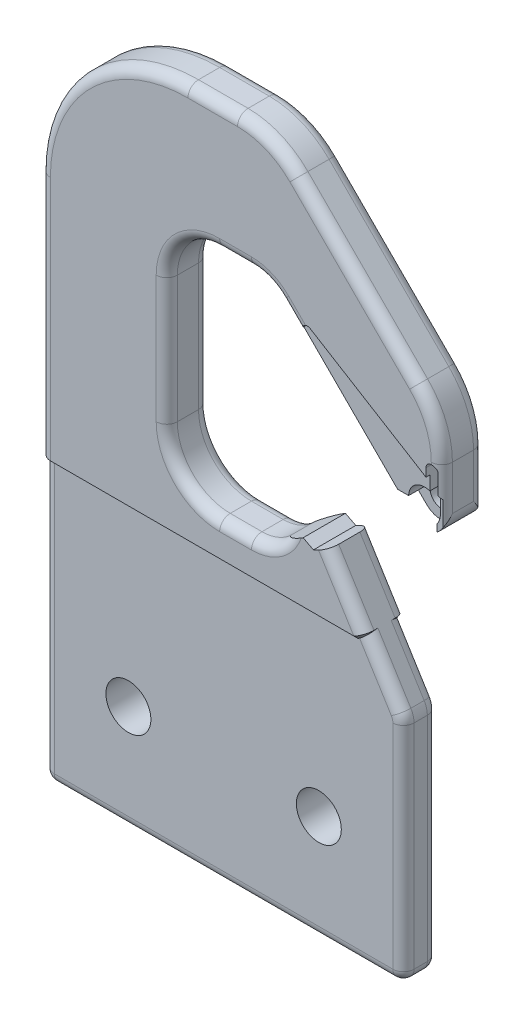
SolidWorks part; units mm, degrees
ref_plane "Front Plane" through (0, 0, 0) normal (0, 0, 1) x (1, 0, 0)
ref_plane "Top Plane" through (0, 0, 0) normal (0, 1, 0) x (1, 0, 0)
ref_plane "Right Plane" through (0, 0, 0) normal (1, 0, 0) x (0, 0, -1)
sketch "Sketch1" plane through (0, 0, 0) normal (0, 0, 1) x (1, 0, 0)
  line L1 (0, 0) -> (120.65, 0)
  line L2 (0, 0) -> (0, 177.8)
  line L3 (0, 177.8) -> (120.65, 177.8)
  line L4 (120.65, 0) -> (120.65, 177.8)
extrude "Extrude1" add sketch "Sketch1" along normal blind 12.7
fillet "Fillet1" radius 44.45 1 edges at (0, 177.8, 6.35)
sketch "Sketch3" plane through (0, 0, 12.7) normal (0, 0, 1) x (1, 0, 0)
  line L0 (0, 133.35) -> (0, 0) construction
  line L1 (38.1, 139.7) -> (76.2, 139.7)
  line L2 (38.1, 139.7) -> (38.1, 69.85)
  line L3 (38.1, 69.85) -> (76.2, 69.85)
  line L4 (76.2, 139.7) -> (76.2, 69.85)
  line L5 (0, 0) -> (120.65, 0) construction
  dimension "D1" = 38.1
  dimension "D2" = 69.85
  dimension "D3" = 38.1
  dimension "D4" = 69.85
extrude "Cut-Extrude1" cut sketch "Sketch3" against normal through all
fillet "Fillet2" radius 12.7 2 edges at (76.2, 69.85, 6.35) (76.2, 139.7, 6.35)
fillet "Fillet12" radius 15.875 2 edges at (38.1, 69.85, 6.35) (38.1, 139.7, 6.35)
sketch "Sketch5" plane through (0, 0, 12.7) normal (0, 0, 1) x (1, 0, 0)
  line L0 (72.4803, 135.9803) -> (120.65, 87.8105)
  line L1 (120.65, 0) -> (120.65, 177.8) construction
  line L2 (72.4803, 73.5697) -> (84.6446, 81.1219)
  line L3 (84.6446, 81.1219) -> (120.65, 23.1274)
  line L4 (120.65, 23.1274) -> (120.65, 87.8105)
  line L5 (72.4803, 135.9803) -> (72.4803, 73.5697)
  arc A0 (76.2, 127) -> (63.5, 139.7) centre (63.5, 127) ccw construction
  arc A1 (63.5, 69.85) -> (76.2, 82.55) centre (63.5, 82.55) ccw construction
extrude "Cut-Extrude2" cut sketch "Sketch5" against normal through all
fillet "Fillet3" radius 50.8 1 edges at (120.65, 177.8, 6.35)
sketch "Sketch18" plane through (0, 0, 12.7) normal (0, 0, 1) x (1, 0, 0)
  line L1 (0, 0) -> (120.4195, 0)
  line L2 (0, 0) -> (0, -25.4)
  line L3 (0, -25.4) -> (120.4195, -25.4)
  line L4 (120.4195, 0) -> (120.4195, -25.4)
extrude "Extrude2" add sketch "Sketch18" against normal blind 12.7
hole_wizard "1/2 Clearance Hole1" positions "3DSketch1" profile "Sketch9" hole size "1/2" standard "Ansi Inch"
sketch3d "3DSketch1"
  line L0 (120.4195, 0, 12.7) -> (120.65, 0, 12.7) construction
  line L1 (0, 133.35, 12.7) -> (0, -25.4, 12.7) construction
  point P0 (25.4, 6.35, 12.7)
  point P2 (82.55, 6.35, 12.7)
  dimension "D1" = 6.35
  dimension "D2" = 6.35
  dimension "D3" = 57.15
  dimension "D4" = 25.4
sketch "Sketch9" plane through (25.4, 6.35, 12.7) normal (1, 0, 0) x (0, -1, 0)
  line L0 (0, 0) -> (0, 29.4535)
  line L1 (0, 29.4535) -> (6.7462, 25.4)
  line L2 (6.7462, 25.4) -> (6.7462, 0)
  line L5 (6.7462, 0) -> (0, 0)
  line L10 (0, 29.4535) -> (-6.7462, 25.4) construction
  line L11 (0, -6.35) -> (0, 107.95) construction
  dimension "Hole Dia." = 13.4925
  dimension "Hole Depth" = 25.4
  dimension "Drill Angle" = 118
sketch "Sketch11" plane through (0, 0, 12.7) normal (0, 0, 1) x (1, 0, 0)
  line L1 (0, 133.35) -> (0, -25.4) construction
  line L2 (107.95, 63.3788) -> (129.5271, 63.3788)
  line L3 (107.95, 63.3788) -> (107.95, -27.3076)
  line L4 (107.95, -27.3076) -> (129.5271, -27.3076)
  line L9 (129.5271, 63.3788) -> (129.5271, -27.3076)
  dimension "D1" = 107.95
extrude "Cut-Extrude4" cut sketch "Sketch11" against normal through all
sketch "Sketch12" plane through (0, 0, 12.7) normal (0, 0, 1) x (1, 0, 0)
  line L0 (86.5199, 78.1013) -> (82.1201, 76.0239)
  line L1 (84.6446, 81.1219) -> (107.95, 43.5834) construction
  line L3 (84.6446, 81.1219) -> (107.95, 43.5834) construction
  line L8 (82.1201, 76.0239) -> (79.0132, 77.6257)
  line L9 (72.4803, 73.5697) -> (84.6446, 81.1219) construction
  line L10 (79.0132, 77.6257) -> (84.6446, 81.1219)
  line L11 (84.6446, 81.1219) -> (86.5199, 78.1013)
extrude "Cut-Extrude5" cut sketch "Sketch12" against normal through all
fillet "Fillet8" radius 6.35 1 edges at (120.65, 87.8105, 6.35)
hole_wizard "1/4 Clearance Hole1" positions "3DSketch2" profile "Sketch13" hole size "1/4" standard "ANSI Inch"
sketch3d "3DSketch2"
  line L0 (120.65, 103.1408, 12.7) -> (120.65, 127, 12.7) construction
  point P0 (114.3, 103.1408, 12.7)
  dimension "D1" = 6.35
  dimension "D2" = 6.35
sketch "Sketch13" plane through (114.3, 103.1408, 12.7) normal (1, 0, 0) x (0, -1, 0)
  line L0 (0, 0) -> (0, 27.4298)
  line L1 (0, 27.4298) -> (3.3782, 25.4)
  line L2 (3.3782, 25.4) -> (3.3782, 0)
  line L5 (3.3782, 0) -> (0, 0)
  line L10 (0, 27.4298) -> (-3.3782, 25.4) construction
  line L11 (0, -6.35) -> (0, 107.95) construction
  dimension "Hole Dia." = 6.7564
  dimension "Hole Depth" = 25.4
  dimension "Drill Angle" = 118
sketch "Sketch15" plane through (0, 0, 12.7) normal (0, 0, 1) x (1, 0, 0)
  circle A0 centre (114.3, 103.1408) radius 4.7625
extrude "Cut-Extrude7" cut sketch "Sketch15" against normal blind 6.223
sketch "Sketch20" plane through (0, 0, 12.7) normal (0, 0, 1) x (1, 0, 0)
  line L0 (77.7635, 130.697) -> (79.795, 133.858)
  line L1 (109.8099, 98.6506) -> (72.4803, 135.9803) construction
  line L2 (79.795, 133.858) -> (116.49, 111.4245)
  line L3 (116.49, 111.4245) -> (120.65, 106.4209)
  line L4 (120.65, 103.1408) -> (120.65, 127) construction
  line L5 (120.65, 106.4209) -> (120.65, 77.9674)
  line L6 (120.65, 77.9674) -> (77.7635, 130.697)
extrude "Cut-Extrude9" cut sketch "Sketch20" against normal blind 1.143
sketch "Sketch21" plane through (0, 0, 0) normal (0, 0, -1) x (-1, 0, 0)
  line L0 (-120.65, 106.4209) -> (-116.49, 111.4245)
  line L1 (-116.49, 111.4245) -> (-79.795, 133.858)
  line L2 (-79.795, 133.858) -> (-77.7635, 130.697)
  line L3 (-77.7635, 130.697) -> (-120.65, 79.1139)
  line L4 (-120.65, 79.1139) -> (-120.65, 106.4209)
extrude "Cut-Extrude10" cut sketch "Sketch21" against normal blind 1.143
fillet "Fillet9" radius 1.5875 4 edges at (79.795, 133.858, 0.5715) (79.795, 133.858, 12.1285) (116.49, 111.4245, 12.1285) (116.49, 111.4245, 0.5715)
sketch "Sketch22" plane through (0, 0, 12.7) normal (0, 0, 1) x (1, 0, 0)
  line L1 (119.0625, 103.1408) -> (115.8875, 103.1408)
  line L2 (119.0625, 103.1408) -> (119.0625, 115.8408)
  line L3 (119.0625, 115.8408) -> (115.8875, 115.8408)
  line L4 (115.8875, 103.1408) -> (115.8875, 115.8408)
  circle A1 centre (114.3, 103.1408) radius 4.7625 construction
  circle A2 centre (114.3, 103.1408) radius 4.7625 construction
extrude "Cut-Extrude11" cut sketch "Sketch22" against normal blind 6.223
sketch "Sketch23" plane through (0, 0, 12.7) normal (0, 0, 1) x (1, 0, 0)
  line L0 (105.1935, 103.267) -> (117.4227, 86.3214)
  line L1 (117.4227, 86.3214) -> (118.1167, 100.2923)
  line L2 (109.8099, 98.6506) -> (77.7635, 130.697) construction
  line L3 (105.1935, 103.267) -> (109.5392, 103.267)
  line L4 (118.1167, 100.2923) -> (109.5392, 103.267)
  circle A0 centre (114.3, 103.1408) radius 4.7625 construction
  circle A1 centre (114.3, 103.1408) radius 4.7625 construction
extrude "Cut-Extrude12" cut sketch "Sketch23" against normal blind 6.223
sketch "Sketch24" plane through (0, -25.4, 0) normal (0, -1, 0) x (1, 0, 0)
  line L1 (107.95, 12.7) -> (107.95, 0) construction
  line L2 (0, 12.7) -> (107.95, 12.7)
  line L3 (0, 12.7) -> (0, 11.5189)
  line L4 (0, 11.5189) -> (107.95, 11.5189)
  line L6 (107.95, 12.7) -> (107.95, 11.5189)
  line L7 (0, 0) -> (0, 12.7) construction
  line L8 (107.95, 0) -> (0, 0)
  line L9 (107.95, 0) -> (107.95, 1.1811)
  line L10 (107.95, 1.1811) -> (0, 1.1811)
  line L11 (0, 0) -> (0, 1.1811)
extrude "Cut-Extrude13" cut sketch "Sketch24" against normal blind 82.55
sketch "Sketch25" plane through (0, 0, 12.7) normal (0, 0, 1) x (1, 0, 0)
  line L0 (120.65, 127) -> (69.85, 177.8)
  line L2 (69.85, 177.8) -> (120.65, 177.8)
  line L3 (120.65, 177.8) -> (120.65, 127)
extrude "Cut-Extrude14" cut sketch "Sketch25" against normal through all
fillet "Fillet16" radius 25.4 2 edges at (120.65, 127, 6.35) (69.85, 177.8, 6.35)
fillet "Fillet17" radius 1.5875 2 edges at (119.0625, 115.8408, 9.5885) (115.8875, 115.8408, 9.5885)
fillet "Fillet18" radius 3.175 32 edges at (68.3601, 70.8167, 0) (58.7375, 69.85, 0) (42.7497, 74.4997, 0) (38.1, 104.775, 0) (42.7497, 135.0503, 0) (58.7375, 139.7, 0) (68.3601, 138.7333, 0) (0, 95.25, 0) (13.0191, 164.7809, 0) (51.8895, 177.8, 0) (69.0491, 175.8665, 0) (95.25, 152.4, 0) (120.65, 111.4499, 0) (68.3601, 70.8167, 12.7) (58.7375, 69.85, 12.7) (42.7497, 74.4997, 12.7) (38.1, 104.775, 12.7) (42.7497, 135.0503, 12.7) (58.7375, 139.7, 12.7) (68.3601, 138.7333, 12.7) (120.65, 111.4499, 12.7) (118.7165, 126.1991, 12.7) (95.25, 152.4, 12.7) (69.0491, 175.8665, 12.7) (51.8895, 177.8, 12.7) (13.0191, 164.7809, 12.7) (93.0236, 67.6256, 0) (75.1219, 133.3386, 0) (118.7165, 126.1991, 0) (93.0236, 67.6256, 12.7) (75.1219, 133.3386, 12.7) (0, 95.25, 12.7)
fillet "Fillet19" radius 3.175 2 edges at (107.95, -25.4, 6.35) (0, -25.4, 6.35)
fillet "Fillet20" radius 6.35 1 edges at (107.95, 43.5834, 6.35)
fillet "Fillet21" radius 3.175 10 edges at (107.9449, 42.0271, 1.1811) (107.95, 9.7738, 1.1811) (107.0201, -24.4701, 1.1811) (1.8057, -25.0895, 1.1811) (107.9449, 42.0271, 11.5189) (107.95, 9.7738, 11.5189) (107.0201, -24.4701, 11.5189) (53.975, -25.4, 1.1811) (53.975, -25.4, 11.5189) (1.8057, -25.0895, 11.5189)
chamfer "Chamfer1" distance 2.54 angle 45 10 edges at (0, 57.15, 3.7655) (99.5273, 57.15, 3.7655) (0.9299, 57.15, 0.9299) (98.4327, 57.15, 0.9299) (49.4826, 57.15, 0) (99.5273, 57.15, 8.9344) (0, 57.15, 8.9344) (98.4327, 57.15, 11.7701) (0.9299, 57.15, 11.7701) (49.4826, 57.15, 12.7)
